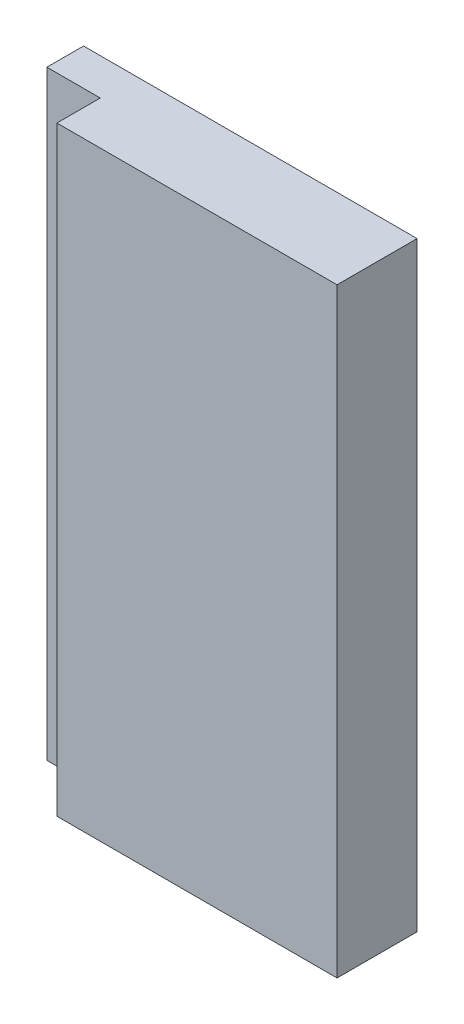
SolidWorks part; units mm, degrees
ref_plane "Plan de face" through (0, 0, 0) normal (0, 0, 1) x (1, 0, 0)
ref_plane "Plan de dessus" through (0, 0, 0) normal (0, 1, 0) x (1, 0, 0)
ref_plane "Plan de droite" through (0, 0, 0) normal (1, 0, 0) x (0, 0, -1)
sketch "Esquisse1" plane through (0, 0, 0) normal (0, 0, 1) x (1, 0, 0)
  line L1 (20, 40) -> (45, 40)
  line L2 (20, 40) -> (20, -5)
  line L3 (20, -5) -> (45, -5)
  line L4 (45, 40) -> (45, -5)
  dimension "D1" = 25
  dimension "D2" = 45
extrude "Extrusion1" add sketch "Esquisse1" along normal blind 6
sketch "Esquisse2" plane through (0, 0, 6) normal (0, 0, 1) x (1, 0, 0)
  line L0 (20, -5) -> (45, -5) construction
  line L1 (20, 40) -> (24, 40)
  line L2 (20, 40) -> (20, -5)
  line L3 (20, -5) -> (24, -5)
  line L4 (24, 40) -> (24, -5)
  dimension "D2" = 4
extrude "Enlèv. mat.-Extru.1" cut sketch "Esquisse2" against normal blind 3.25
